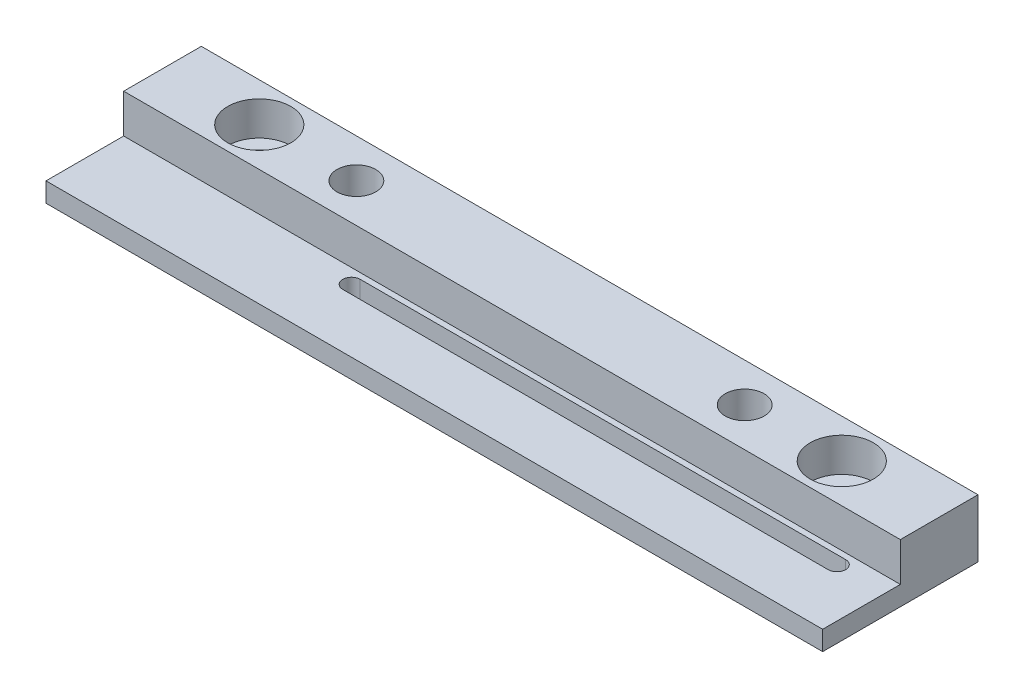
SolidWorks part; units mm, degrees
ref_plane "前视基准面" through (0, 0, 0) normal (0, 0, 1) x (1, 0, 0)
ref_plane "上视基准面" through (0, 0, 0) normal (0, 1, 0) x (1, 0, 0)
ref_plane "右视基准面" through (0, 0, 0) normal (1, 0, 0) x (0, 0, -1)
sketch "草图1" plane through (0, 0, 0) normal (0, 0, 1) x (1, 0, 0)
  line L0 (80, 0) -> (80, 6)
  line L1 (0, 0) -> (0, 6)
  line L2 (0, 0) -> (80, 0)
  line L3 (0, 6) -> (80, 6)
extrude "凸台-拉伸1" add sketch "草图1" along normal blind 16
sketch "草图2" plane through (0, 6, 0) normal (0, 1, 0) x (1, 0, 0)
  line L0 (74.9687, -8.6) -> (24.9687, -8.6)
  line L1 (24.9687, -10.4) -> (74.9687, -10.4)
  circle A0 centre (9.9687, -4) radius 1.75
  circle A1 centre (69.9687, -4) radius 1.75
  circle A2 centre (19.9687, -4) radius 2
  circle A3 centre (59.9687, -4) radius 2
  arc A4 (24.9687, -8.6) -> (24.9687, -10.4) centre (24.9687, -9.5) ccw
  arc A5 (74.9687, -10.4) -> (74.9687, -8.6) centre (74.9687, -9.5) ccw
extrude "切除-拉伸1" cut sketch "草图2" against normal blind 16
sketch "草图3" plane through (0, 6, 0) normal (0, 1, 0) x (1, 0, 0)
  circle A0 centre (9.9687, -4) radius 3.25
  circle A1 centre (69.9687, -4) radius 3.25
extrude "切除-拉伸2" cut sketch "草图3" against normal blind 3.5
sketch "草图4" plane through (80, 0, 0) normal (1, 0, 0) x (0, 0, -1)
  line L0 (-8, 2) -> (-8, 6)
  line L1 (-16, 2) -> (-8, 2)
extrude "切除-拉伸3" cut sketch "草图4" against normal through all and the other way through all
